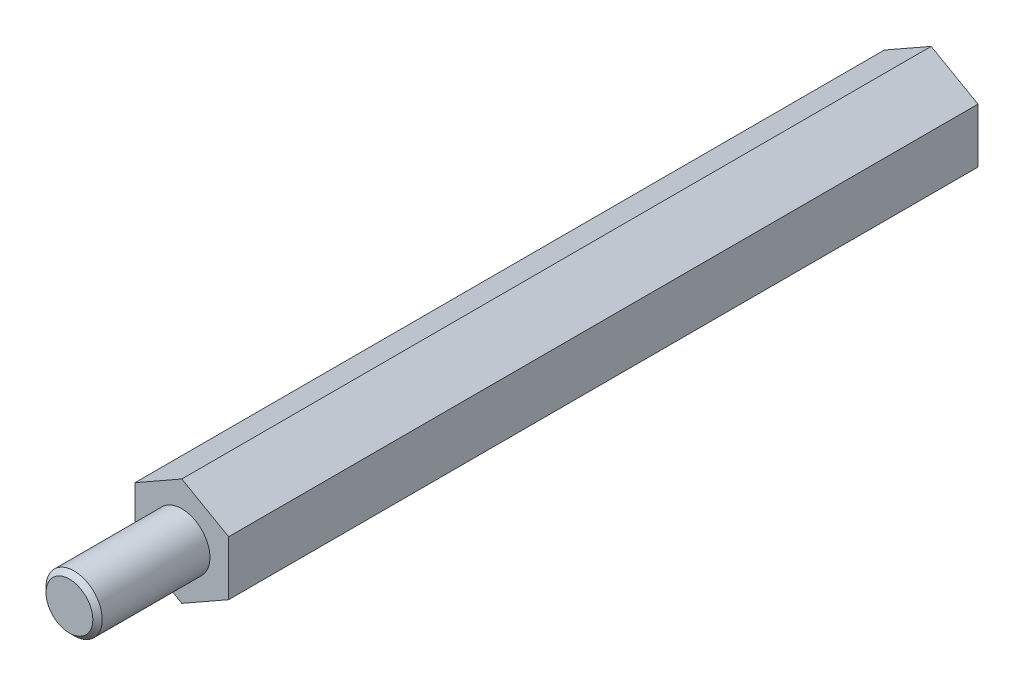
SolidWorks part; units mm, degrees
ref_plane "Plan de face" through (0, 0, 0) normal (0, 0, 1) x (1, 0, 0)
ref_plane "Plan de dessus" through (0, 0, 0) normal (0, 1, 0) x (1, 0, 0)
ref_plane "Plan de droite" through (0, 0, 0) normal (1, 0, 0) x (0, 0, -1)
sketch "Esquisse1" plane through (0, 0, 0) normal (0, 0, 1) x (1, 0, 0)
  line L0 (0, 0) -> (0, 36.0001) construction
  line L1 (0, 0) -> (38.4525, 0) construction
  line L2 (5, -2.9105) -> (5, 2.9105)
  line L3 (5, 2.9105) -> (0, 5.75)
  line L4 (-5, 2.9105) -> (0, 5.75)
  line L5 (-5, -2.9105) -> (-5, 2.9105)
  line L6 (-5, -2.9105) -> (0, -5.75)
  line L7 (5, -2.9105) -> (0, -5.75)
  point P10 (-5, 0)
  point P12 (5, 0)
  dimension "D1" = 10
  dimension "D2" = 10
  dimension "D3" = 11.5
extrude "Extrusion1" add sketch "Esquisse1" along normal blind 80
hole_wizard "Trou taraudé M61" positions "Esquisse3D1" profile "Esquisse2" tap size "M6" standard "ISO"
sketch3d "Esquisse3D1"
  point P8 (0, 0, 0)
sketch "Esquisse2" plane through (0, 0, 0) normal (1, 0, 0) x (0, 1, 0)
  line L0 (0, 0) -> (0, 18.5022)
  line L1 (0, 18.5022) -> (2.5, 17)
  line L2 (2.5, 17) -> (2.5, 1)
  line L3 (2.5, 1) -> (3.5, 0)
  line L5 (3.5, 0) -> (0, 0)
  line L6 (-2.5, 1) -> (-3.5, 0) construction
  line L10 (0, 18.5022) -> (-2.5, 17) construction
  line L11 (0, -6.35) -> (0, 107.95) construction
  dimension "Diamètre du trou pour taraudage" = 5
  dimension "Profondeur du trou pour taraudage" = 17
  dimension "Diamètre du fraisage entrant" = 7
  dimension "Angle du fraisage entrant" = 90
  dimension "Angle de pointe" = 118
sketch "Esquisse3" plane through (0, 0, 80) normal (0, 0, 1) x (1, 0, 0)
  circle A0 centre (0, 0) radius 3
  dimension "D1" = 6
extrude "Extrusion2" add sketch "Esquisse3" along normal blind 12
chamfer "Chanfrein1" distance 0.5 angle 45 1 edges at (3, 0, 92)
